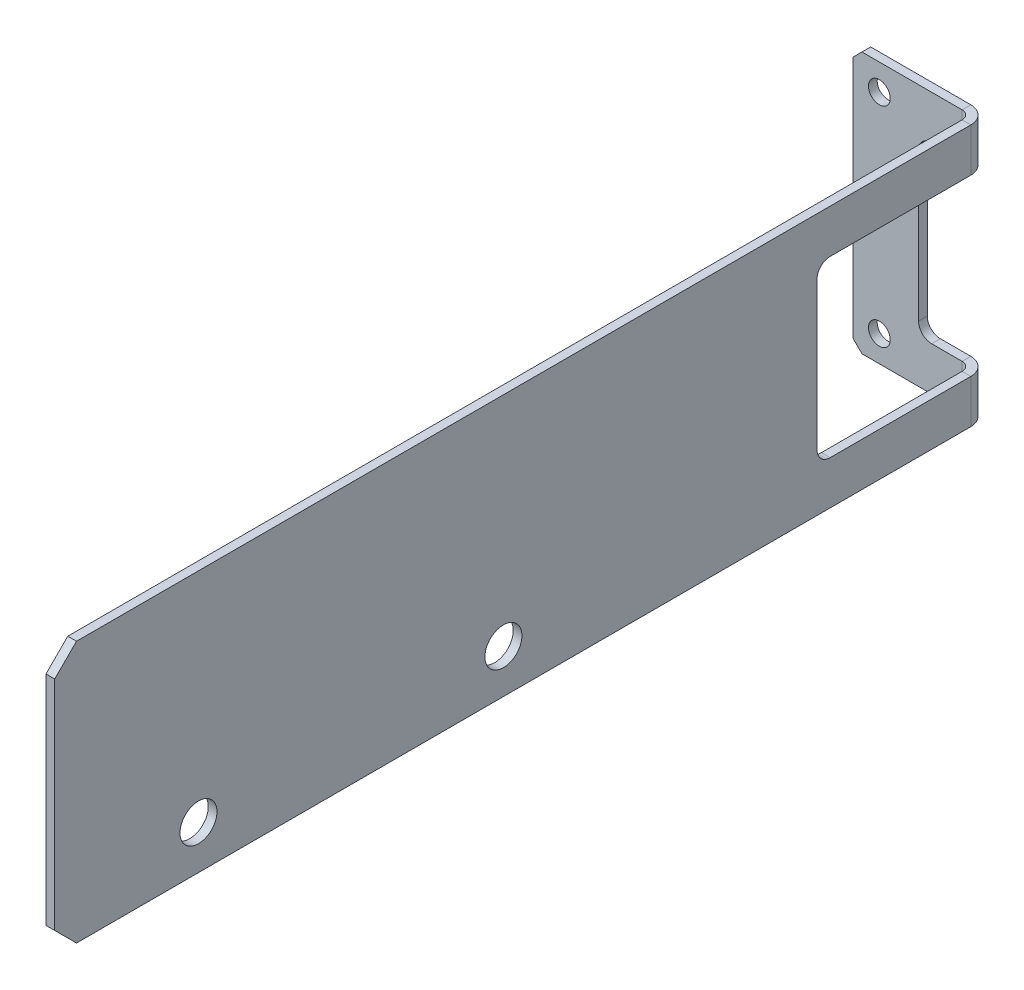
SolidWorks part; units mm, degrees
ref_plane "Plan de face" through (0, 0, 0) normal (0, 0, 1) x (1, 0, 0)
ref_plane "Plan de dessus" through (0, 0, 0) normal (0, 1, 0) x (1, 0, 0)
ref_plane "Plan de droite" through (0, 0, 0) normal (1, 0, 0) x (0, 0, -1)
sketch "Esquisse1" plane through (0, 0, 0) normal (0, 0, 1) x (1, 0, 0)
  line L0 (-90, 30) -> (-90, -30) construction
  line L1 (-120, 30) -> (120, 30)
  line L2 (-120, 30) -> (-120, -30)
  line L3 (-120, -30) -> (120, -30)
  line L4 (120, 30) -> (120, -30)
  line L5 (-120, 30) -> (120, -30) construction
  line L6 (-120, -30) -> (120, 30) construction
  point P0 (0, 0)
  dimension "D1" = 240
  dimension "D2" = 60
  dimension "D3" = 30
sheet metal parameters "Supprimer la liaison sélectionnée (en développement)1" thickness 2 parameters "D1"=9
base flange "Tôle de base pliée1" sketch "Esquisse1" thickness 2 reverse thickness direction yes parameters "D1"=9
sketch "Esquisse7" plane through (0, 0, 2) normal (0, 0, 1) x (1, 0, 0)
  line L0 (120, -30) -> (120, 30) construction
  line L1 (-120, -30) -> (120, -30) construction
  circle A0 centre (87, -20) radius 4.25
  circle A1 centre (17, -20) radius 4.25
  dimension "D1" = 33
  dimension "D2" = 70
  dimension "D3" = 10
  dimension "D4" = 8.5
  dimension "D5" = 8.5
  dimension "D6" = 10
extrude "Extrusion2" cut sketch "Esquisse7" against normal up to next
sketch "Esquisse8" plane through (0, 0, 2) normal (0, 0, 1) x (1, 0, 0)
  line L0 (-120, 30) -> (-120, -30) construction
  line L1 (120, 30) -> (-120, 30) construction
  line L2 (-102, 20) -> (-58, 20)
  line L3 (-105, 17) -> (-105, -17)
  line L4 (-102, -20) -> (-58, -20)
  line L7 (-55, 17) -> (-55, -17)
  line L9 (-120, -30) -> (120, -30) construction
  arc A0 (-102, 20) -> (-105, 17) centre (-102, 17) ccw
  arc A1 (-58, 20) -> (-55, 17) centre (-58, 17) cw
  arc A2 (-58, -20) -> (-55, -17) centre (-58, -17) ccw
  arc A3 (-105, -17) -> (-102, -20) centre (-102, -17) ccw
  point P12 (-105, 20)
  point P15 (-55, 20)
  dimension "D4" = 10
  dimension "D5" = 3
  dimension "D1" = 10
  dimension "D2" = 50
  dimension "D3" = 15
extrude "Extrusion3" cut sketch "Esquisse8" against normal up to next
chamfer "Chanfrein2" distance 5 angle 45 2 edges at (120, -30, 1) (120, 30, 1)
sketch "Esquisse11" plane through (0, 0, 2) normal (0, 0, 1) x (1, 0, 0)
  line L0 (115, 30) -> (-120, 30) construction
  line L1 (-120, 30) -> (-120, -30) construction
  circle A0 centre (-114, 24) radius 2.5
  circle A1 centre (-114, -24) radius 2.5
  dimension "D1" = 6
  dimension "D2" = 48
  dimension "D3" = 6
  dimension "D4" = 5
extrude "Extrusion4" cut sketch "Esquisse11" against normal up to next
sketch "Esquisse9" plane through (0, 0, 2) normal (0, 0, 1) x (1, 0, 0)
  line L0 (-92.6491, 30) -> (-92.6491, -30)
  line L4 (115, 30) -> (-120, 30) construction
  line L5 (-120, -30) -> (115, -30) construction
sketched bend "Pli esquissé1" parameters "D1"=2
bend "Pli esquissé2" bend radius 2 bend angle 90 parameters "D5"=1
chamfer "Chanfrein3" distance 2 angle 45 2 edges at (-120, -30, 1) (-120, 30, 1)
flat pattern "Etat déplié1"
sketch "Lignes de pliage1" plane through (0, 0, 2) normal (0, 0, 1) x (1, 0, 0)
  line L0 (-92.6491, -30) -> (-92.6491, 30) construction
  line L1 (-92.6491, -30) -> (-92.6491, -20) construction
  line L2 (-92.6491, 20) -> (-92.6491, 30) construction
  point P0 (-110.6416, -20)
  point P1 (-110.6416, 20)
bend of the flat pattern "Dépliage-<Pli esquissé2>1"
